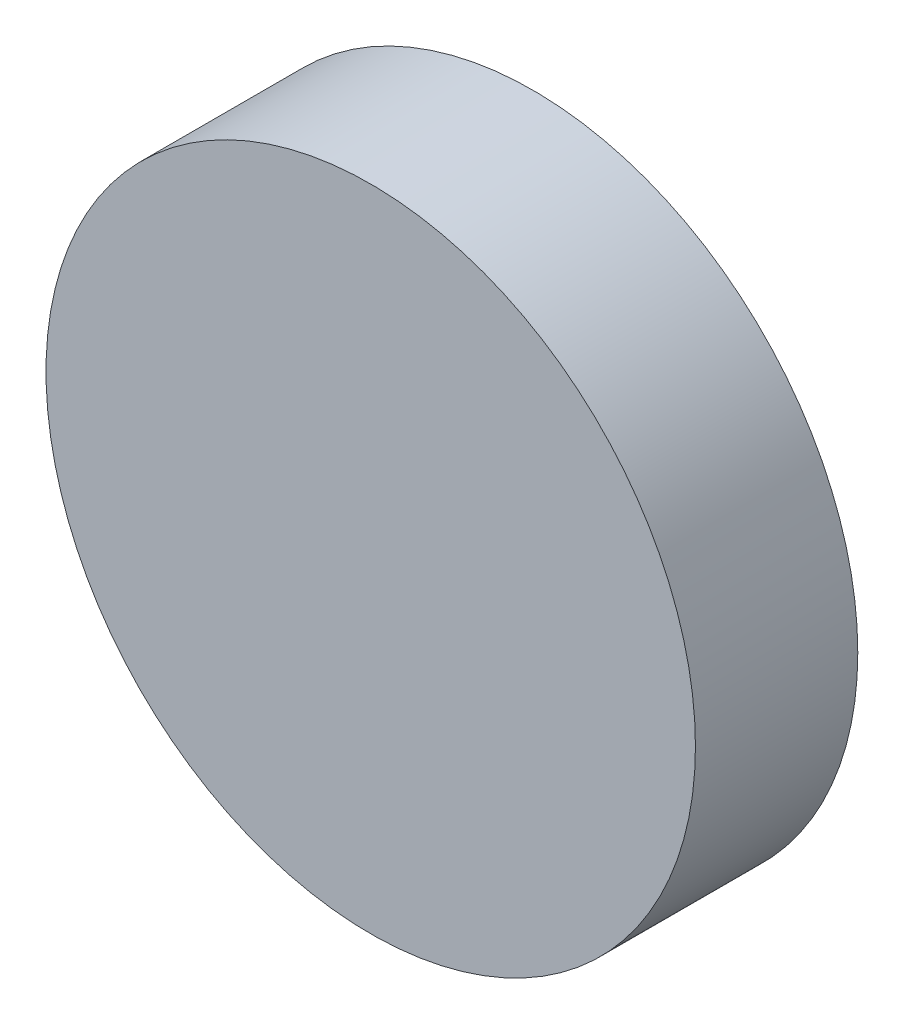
SolidWorks part; units mm, degrees
ref_plane "Ebene vorne" through (0, 0, 0) normal (0, 0, 1) x (1, 0, 0)
ref_plane "Ebene oben" through (0, 0, 0) normal (0, 1, 0) x (1, 0, 0)
ref_plane "Ebene rechts" through (0, 0, 0) normal (1, 0, 0) x (0, 0, -1)
sketch "Skizze1" plane through (0, 0, 0) normal (0, 0, 1) x (1, 0, 0)
  circle A0 centre (0, 0) radius 100
  dimension "D1" = 200
extrude "Aufsatz-Linear austragen1" add sketch "Skizze1" along normal blind 50
